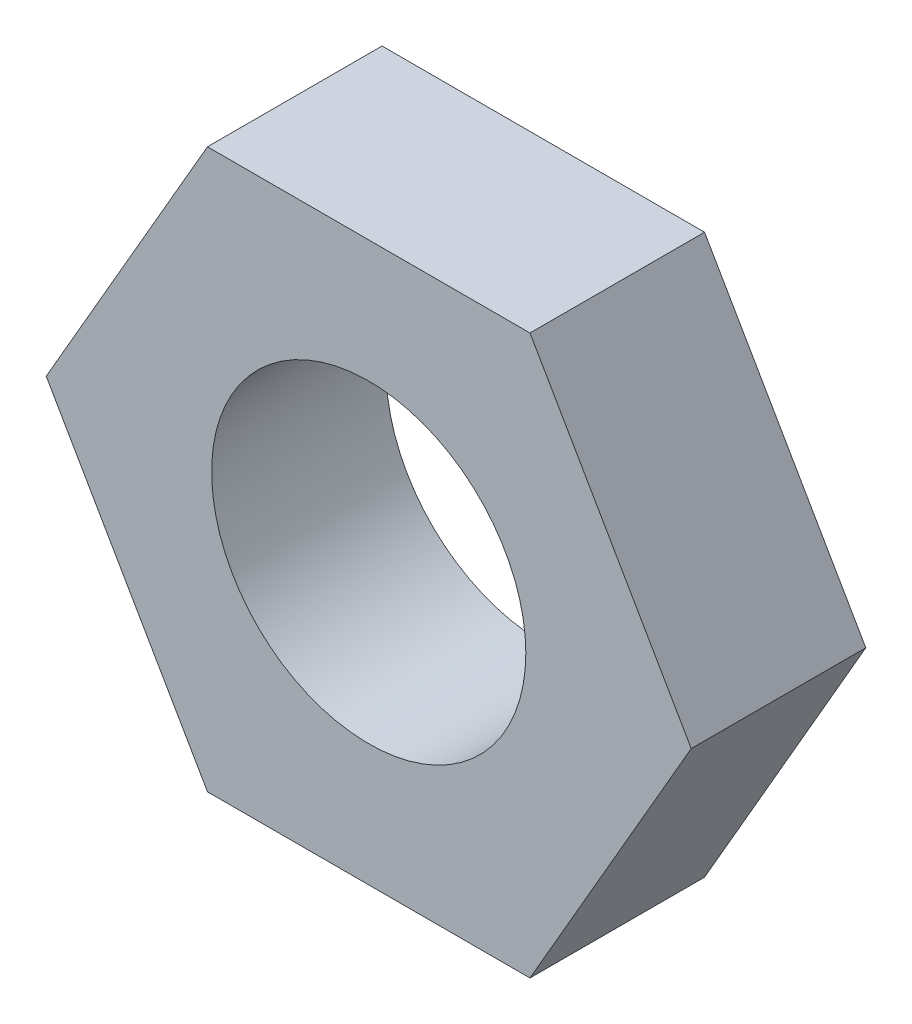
SolidWorks part; units mm, degrees
ref_plane "Front" through (0, 0, 0) normal (0, 0, 1) x (1, 0, 0)
ref_plane "Top" through (0, 0, 0) normal (0, 1, 0) x (1, 0, 0)
ref_plane "Right" through (0, 0, 0) normal (1, 0, 0) x (0, 0, -1)
sketch "Sketch1" plane through (0, 0, 0) normal (0, 0, 1) x (1, 0, 0)
  line L1 (4.6188, -8) -> (9.2376, 0)
  line L2 (9.2376, 0) -> (4.6188, 8)
  line L3 (4.6188, 8) -> (-4.6188, 8)
  line L4 (-4.6188, 8) -> (-9.2376, 0)
  line L5 (-9.2376, 0) -> (-4.6188, -8)
  line L6 (-4.6188, -8) -> (4.6188, -8)
  circle A0 centre (0, 0) radius 8 construction
  circle A1 centre (0, 0) radius 4.5
  dimension "D1" = 9
  dimension "s" = 16
extrude "BaseNut" add sketch "Sketch1" against normal blind 5
sketch "Sketch2" plane through (0, 0, 0) normal (0, 1, 0) x (1, 0, 0)
  line L0 (0, 7.0076) -> (0, -1.3024) construction
  line L1 (4, 5.25) -> (4.5, 5.25)
  line L2 (4.5, 5.25) -> (4.933, 5)
  line L3 (4.933, 5) -> (4.5, 4.75)
  line L4 (4.5, 4.75) -> (4, 4.75)
  line L5 (4, 4.75) -> (4, 5.25)
  line L6 (9.2376, 5) -> (4.6188, 5) construction
  dimension "D1" = 0.5
  dimension "D2" = 9
revolve "Cut-Revolve10" [suppressed] cut sketch "Sketch2" angle 360 about L0
pattern_linear "LPattern10" [suppressed] count 8 spacing 0.6 along (0, 0, 1)
equation "\"D1@Sketch2\" =  ( \"D2@ThreadCosmetic1\" - \"D1@Sketch1\" )  / 2"
equation "\"D2@Sketch2\" = \"D1@Sketch1\""
equation "\"D3@LPattern10\" = \"D1@Sketch2\" * 1.2"
equation "\"D1@LPattern10\" = \"m@BaseNut\" / \"D3@LPattern10\""
